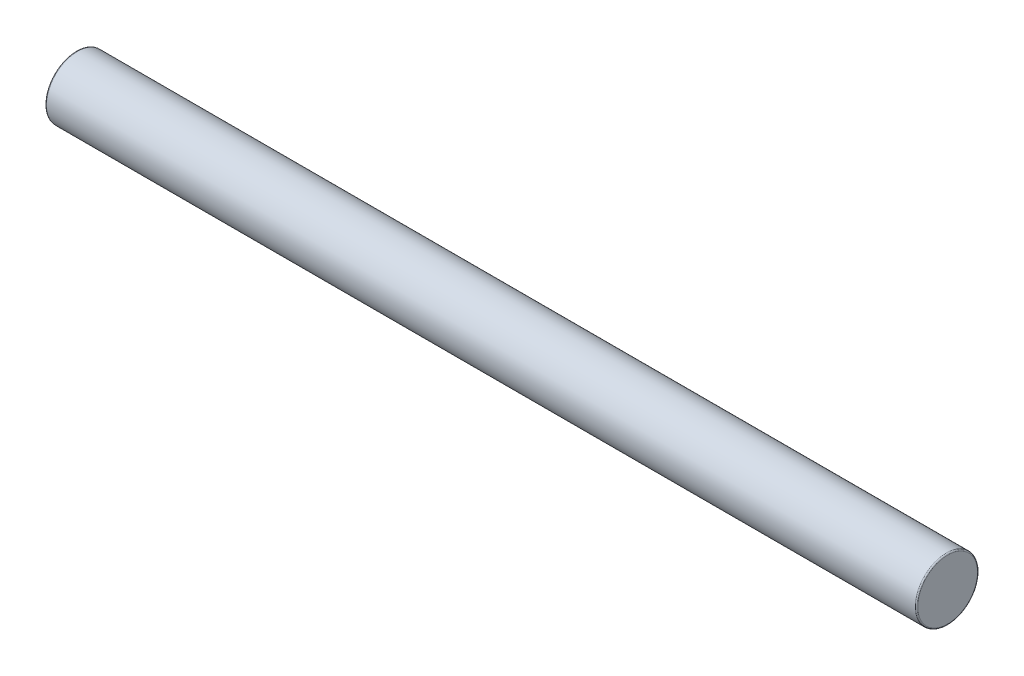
SolidWorks part; units mm, degrees
ref_plane "Front Plane" through (0, 0, 0) normal (0, 0, 1) x (1, 0, 0)
ref_plane "Top Plane" through (0, 0, 0) normal (0, 1, 0) x (1, 0, 0)
ref_plane "Right Plane" through (0, 0, 0) normal (1, 0, 0) x (0, 0, -1)
sketch "Sketch1" plane through (0, 0, 0) normal (1, 0, 0) x (0, 0, -1)
  circle A0 centre (0, 0) radius 5
  dimension "D1" = 10
extrude "Boss-Extrude1" add sketch "Sketch1" along normal blind 140
fillet "Fillet1" radius 0.2 2 edges at (0, 0, -5) (140, 0, -5)
